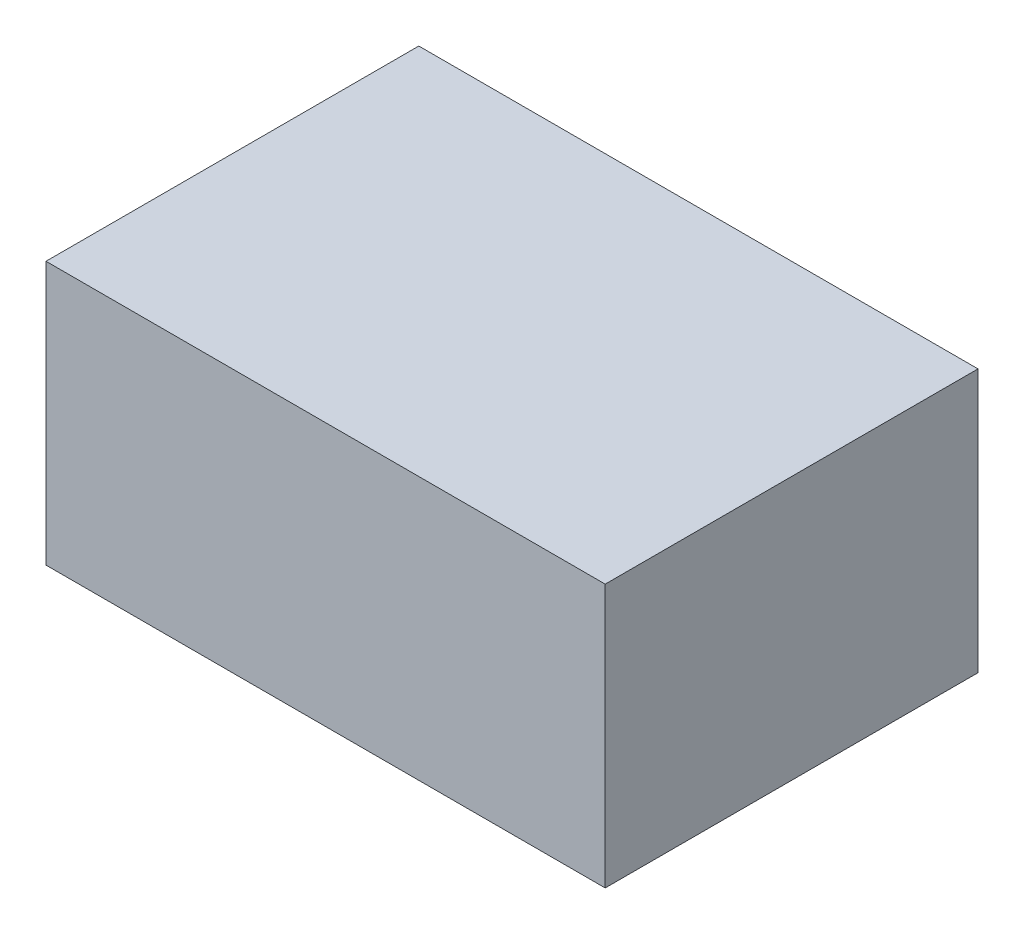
SolidWorks part; units mm, degrees
ref_plane "Plan de face" through (0, 0, 0) normal (0, 0, 1) x (1, 0, 0)
ref_plane "Plan de dessus" through (0, 0, 0) normal (0, 1, 0) x (1, 0, 0)
ref_plane "Plan de droite" through (0, 0, 0) normal (1, 0, 0) x (0, 0, -1)
sketch "Esquisse1" plane through (0, 0, 0) normal (0, 0, 1) x (1, 0, 0)
  line L1 (-50.0115, 130.594) -> (204.9885, 130.594)
  line L2 (-50.0115, 130.594) -> (-50.0115, 10.594)
  line L3 (-50.0115, 10.594) -> (204.9885, 10.594)
  line L4 (204.9885, 130.594) -> (204.9885, 10.594)
  dimension "D1" = 255
  dimension "D2" = 120
extrude "Extrusion1" add sketch "Esquisse1" along normal blind 170
